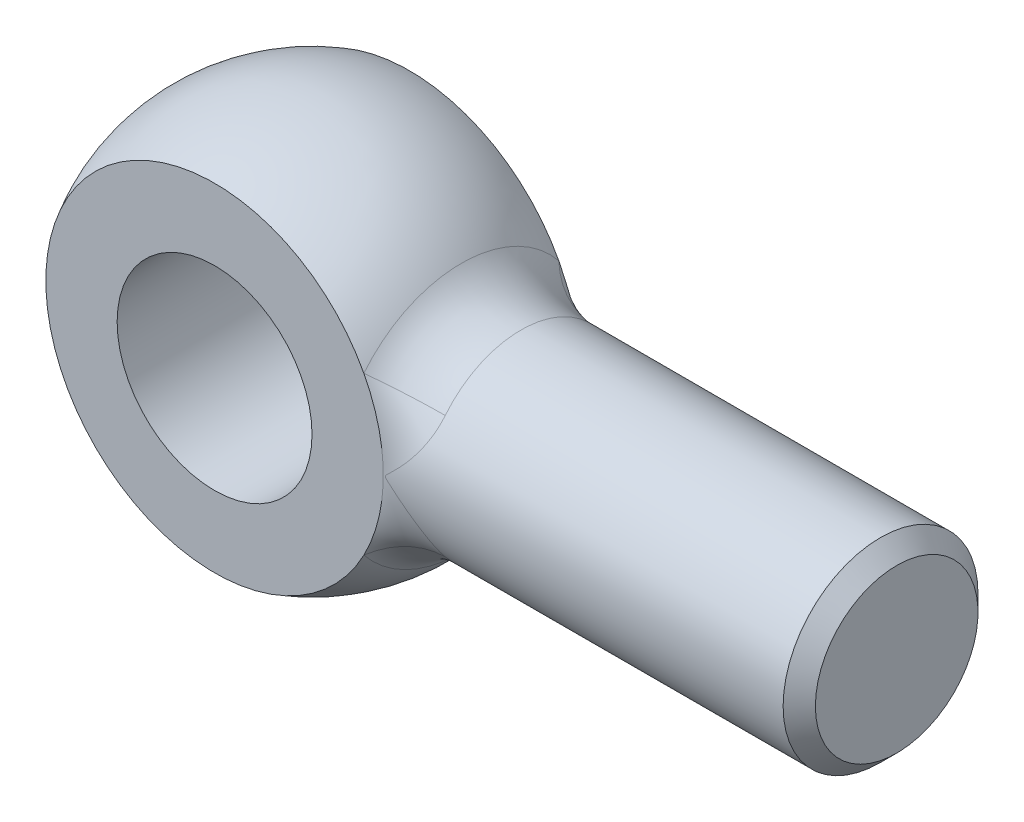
SolidWorks part; units mm, degrees
ref_plane "Plane1" through (0, 0, 0) normal (0, 0, 1) x (1, 0, 0)
ref_plane "Plane2" through (0, 0, 0) normal (0, 1, 0) x (1, 0, 0)
ref_plane "Plane3" through (0, 0, 0) normal (1, 0, 0) x (0, 0, -1)
sketch "BodySke" plane through (0, 0, 0) normal (0, 0, 1) x (1, 0, 0)
  line L0 (0, 0) -> (0, 5)
  line L3 (0, 5) -> (29.172, 5)
  line L4 (30, 4.172) -> (30, 0)
  line L5 (30, 0) -> (0, 0)
  line L6 (-31.75, 0) -> (127, 0) construction
  line L8 (30, 4.172) -> (29.172, 5)
  line L10 (30, -4.172) -> (29.172, -5) construction
  line L11 (1.5, 4.525) -> (1.5, -1.825) construction
  line L12 (0, 5) -> (0, -1.825) construction
  line L13 (10, 4.525) -> (10, -1.825) construction
  dimension "Diameter" = 10
  dimension "Length" = 30
  dimension "Body_ch_ang" = 45
  dimension "Minor_dia" = 8.344
  dimension "Advance" = 1.5
  dimension "Thread_nom" = 20
revolve "Base-Revolve" add sketch "BodySke" angle 360 about L6
sketch "EyeSke" plane through (0, 0, 0) normal (1, 0, 0) x (0, 0, -1)
  line L0 (5.0012, 0) -> (-5.0013, 0)
  line L1 (5.0012, 8.6595) -> (5.0012, 0)
  line L2 (-5.0013, 8.6595) -> (-5.0013, 0)
  line L3 (5.0012, 0) -> (-5.0013, 0) construction
  arc A0 (5.0012, 8.6595) -> (-5.0013, 8.6595) centre (0, 0) ccw
  dimension "Head_dia" = 20
  dimension "Head_thickness" = 10.0025
revolve "Eye" add sketch "EyeSke" angle 360 about L3
sketch "PupilSke" plane through (0, 0, 5.0013) normal (0, 0, 1) x (1, 0, 0)
  circle A0 centre (0, 0) radius 5
  dimension "Diameter" = 10
extrude "Pupil" cut sketch "PupilSke" against normal through all
fillet "Fillet1" radius 4 1 edges at (8.6603, 0, 5)
sketch "ThdSchSke" plane through (0, 0, 0) normal (0, 0, 1) x (1, 0, 0)
  line L0 (11.5, -4.172) -> (10.9202, -5)
  line L1 (11.5, -4.172) -> (12.0798, -5)
  line L2 (12.0798, -5) -> (12.0798, -6.25)
  line L3 (-3.175, 0) -> (5.1513, 0) construction
  line L5 (12.0798, -6.25) -> (10.9202, -6.25)
  line L6 (10.9202, -6.25) -> (10.9202, -5)
  dimension "Thread_minor" = 8.344
  dimension "Diameter" = 10
  dimension "Start" = 11.5
  dimension "SideAngle" = 55
  dimension "VeeAngle" = 70
  dimension "Overcut" = 12.5
revolve "ThreadSchematic" [suppressed] cut sketch "ThdSchSke" angle 360 about L3
pattern_linear "ThdSchPat" [suppressed]
equation "\"Thread_minor@ThreadCosmetic\"  =  \"Minor_dia@BodySke\""
equation "\"Thread_length@ThreadCosmetic\" = \"Thread_nom@BodySke\" - \"Advance@BodySke\""
equation "\"Thread_minor@ThdSchSke\" = \"Minor_dia@BodySke\""
equation "\"Diameter@ThdSchSke\" = \"Diameter@BodySke\""
equation "\"Overcut@ThdSchSke\" = \"Diameter@BodySke\" * 1.25"
equation "\"Start@ThdSchSke\" = \"Length@BodySke\" - \"Thread_length@ThreadCosmetic\""
equation "\"Num_threads@ThdSchPat\" = int( \"Thread_length@ThreadCosmetic\" / \"Advance@BodySke\" + 0.999 )  + 1"
equation "\"Advance@ThdSchPat\" = \"Thread_length@ThreadCosmetic\" /  (\"Num_threads@ThdSchPat\" - 1) 'relax it"
equation "\"Num_threads@ThdSchPat\" = \"Num_threads@ThdSchPat\" - sgn( \"Num_threads@ThdSchPat\" - 1) '---chamfered tips only---"
